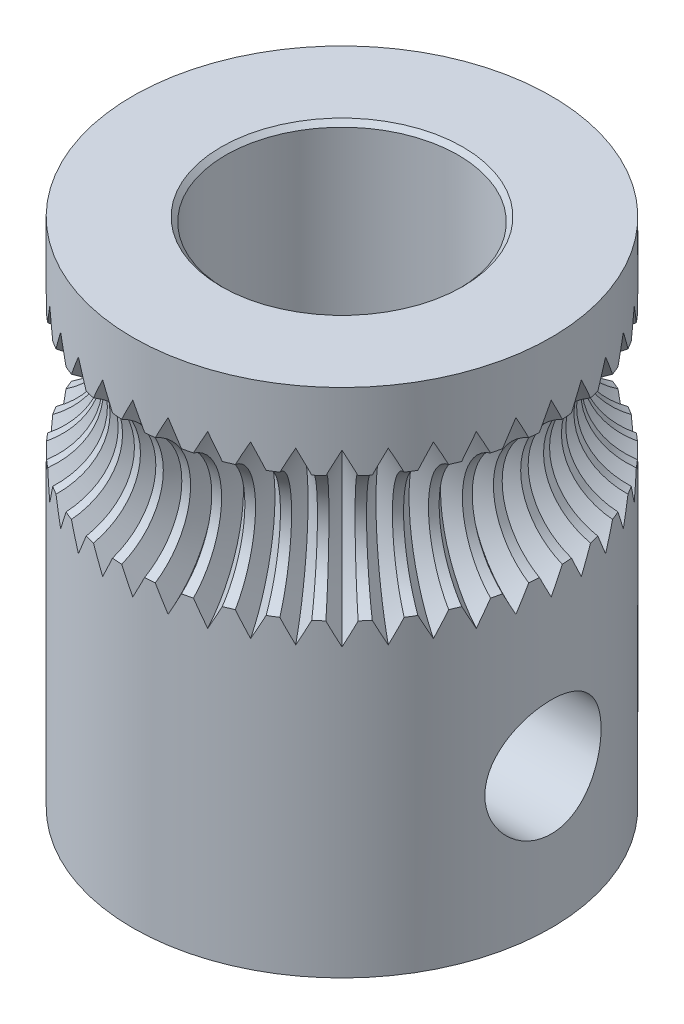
SolidWorks part; units mm, degrees
ref_plane "Спереди" through (0, 0, 0) normal (0, 0, 1) x (1, 0, 0)
ref_plane "Сверху" through (0, 0, 0) normal (0, 1, 0) x (1, 0, 0)
ref_plane "Справа" through (0, 0, 0) normal (1, 0, 0) x (0, 0, -1)
sketch "Эскиз1" plane through (0, 0, 0) normal (0, 0, 1) x (1, 0, 0)
  line L0 (0, 28.4967) -> (0, 0) construction
  line L1 (0, 0) -> (17.1134, 0) construction
  line L2 (2.5, 0) -> (2.5, 11)
  line L3 (2.5, 11) -> (4.5, 11)
  line L4 (4.5, 11) -> (4.5, 9.3519)
  line L7 (4.5, 0) -> (2.5, 0)
  line L8 (4.5, 6.6481) -> (4.5, 0)
  line L9 (3.65, 8) -> (3.65, 12.0898) construction
  arc A0 (4.5, 9.3519) -> (4.5, 6.6481) centre (5.15, 8) ccw
  dimension "D6" = 3.65
  dimension "D8" = 1.5
  dimension "D1" = 5
  dimension "D2" = 9
  dimension "D3" = 11
  dimension "D7" = 3
revolve "Повернуть1" add sketch "Эскиз1" angle 360 about L0
chamfer "Фаска1" distance 0.1 angle 45 2 edges at (0, 11, 2.5) (0, 0, 2.5)
sketch "Эскиз2" plane through (0, 0, 0) normal (0, 0, 1) x (1, 0, 0)
  line L0 (0, 0) -> (0, 15.3711) construction
  line L1 (-3.65, 8) -> (14.25, 8) construction
  circle A0 centre (5.3, 8) radius 1
  arc A1 (-4.5, 6.6481) -> (-4.5, 9.3519) centre (-5.15, 8) ccw construction
  dimension "D1" = 2
  dimension "D2" = 5.3
ref_plane "Плоскость1" through (0, 8, 0) normal (0, -1, 0) x (1, 0, 0)
sketch "Эскиз3" plane through (0, 8, 0) normal (0, -1, 0) x (1, 0, 0)
  line L0 (7.3, 0) -> (6.5753, -0.4184)
  line L1 (-3.65, 0) -> (14.25, 0) construction
  line L2 (6.3, 0) -> (4.3, 0) construction
  line L3 (6.5753, -0.4184) -> (6.5753, 0.4184)
  line L4 (6.5753, 0.4184) -> (7.3, 0)
  line L5 (0, 0) -> (15.5136, 0) construction
  point P10 (6.5753, 0)
  dimension "D1" = 60
  dimension "D2" = 7.3
sweep "Вырез-По траектории1" cut profiles "Эскиз3" path "Эскиз2"
pattern_circular "Круговой массив1" count 40 over 360 about axis through (0, 28.4967, 0) along (0, 1, 0) of "Вырез-По траектории1"
hole_wizard "Отверстие обработанное метчиком M31" positions "Эскиз6" profile "Эскиз4" tap size "M3" standard "GOST"
sketch "Эскиз6" plane through (0, 0, 0) normal (1, 0, 0) x (0, 0, -1)
  point P0 (0, 3)
  dimension "D1" = 3
sketch "Эскиз4" plane through (0, 3, 0) normal (0, 1, 0) x (0, 0, 1)
  line L0 (0, 0) -> (0, 9.2511)
  line L1 (0, 9.2511) -> (1.25, 8.5)
  line L2 (1.25, 8.5) -> (1.25, 0)
  line L5 (1.25, 0) -> (0, 0)
  line L10 (0, 9.2511) -> (-1.25, 8.5) construction
  line L11 (0, -6.35) -> (0, 107.95) construction
  dimension "Диаметр сверла" = 2.5
  dimension "Глубина сверла" = 8.5
  dimension "Угол заточки сверла" = 118
